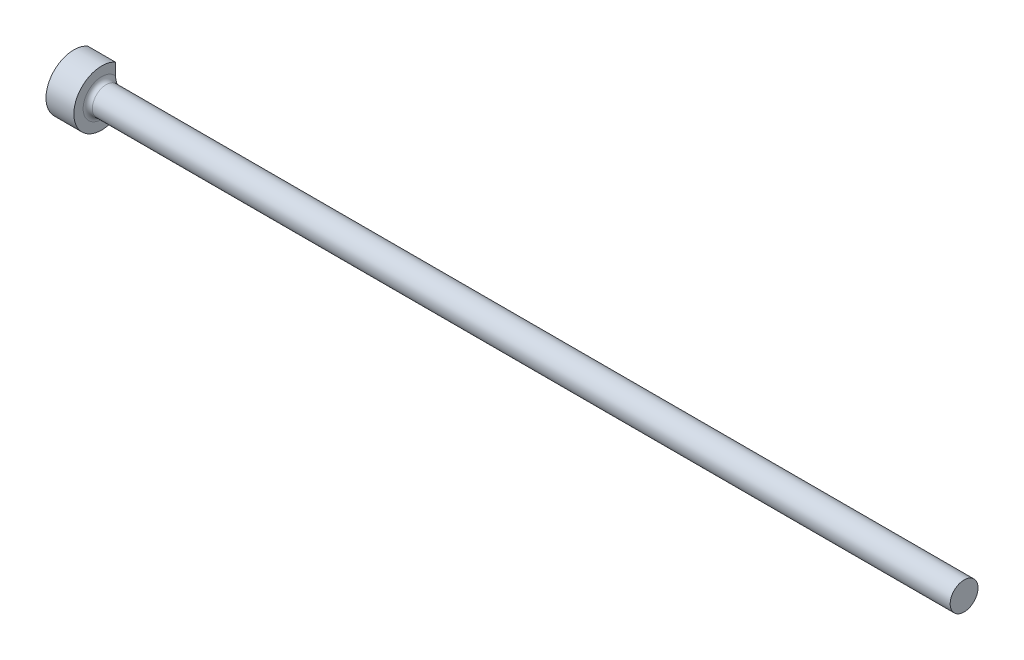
SolidWorks part; units mm, degrees
ref_plane "Front Plane" through (0, 0, 0) normal (0, 0, 1) x (1, 0, 0)
ref_plane "Top Plane" through (0, 0, 0) normal (0, 1, 0) x (1, 0, 0)
ref_plane "Right Plane" through (0, 0, 0) normal (1, 0, 0) x (0, 0, -1)
sketch "Sketch1" plane through (0, 0, 0) normal (0, 0, 1) x (1, 0, 0)
  line L0 (0, 0) -> (0, 4.7625)
  line L1 (0, 4.7625) -> (4.7625, 4.7625)
  line L2 (4.7625, 4.7625) -> (4.7625, 3.1687)
  line L3 (5.5499, 2.3813) -> (152.4, 2.3813)
  line L4 (152.4, 2.3813) -> (152.4, 0)
  line L5 (152.4, 0) -> (0, 0)
  line L6 (152.4, 0) -> (0, 0) construction
  line L7 (0, 0) -> (-10.4771, 0) construction
  line L8 (152.4, 0) -> (1002.3976, 0) construction
  line L9 (5.5499, 2.3813) -> (-7.9138, 2.3812) construction
  arc A0 (5.5499, 2.3813) -> (4.7625, 3.1687) centre (5.5499, 3.1687) cw
  dimension "D1" = 0.7874
  dimension "HeadDia" = 9.525
  dimension "HeadThickness" = 4.7625
  dimension "PinDia" = 4.7625
  dimension "overall" = 152.4
revolve "PIN" add sketch "Sketch1" angle 360 about L6
ref_plane "Plane1" through (78.9749, 0, -2.3813) normal (0, 0, -1) x (0, -1, 0)
ref_plane "CutPlane" through (0, 0, -2.3815) normal (0, 0, -1) x (-1, 0, 0)
other "SurfaceCut1"
